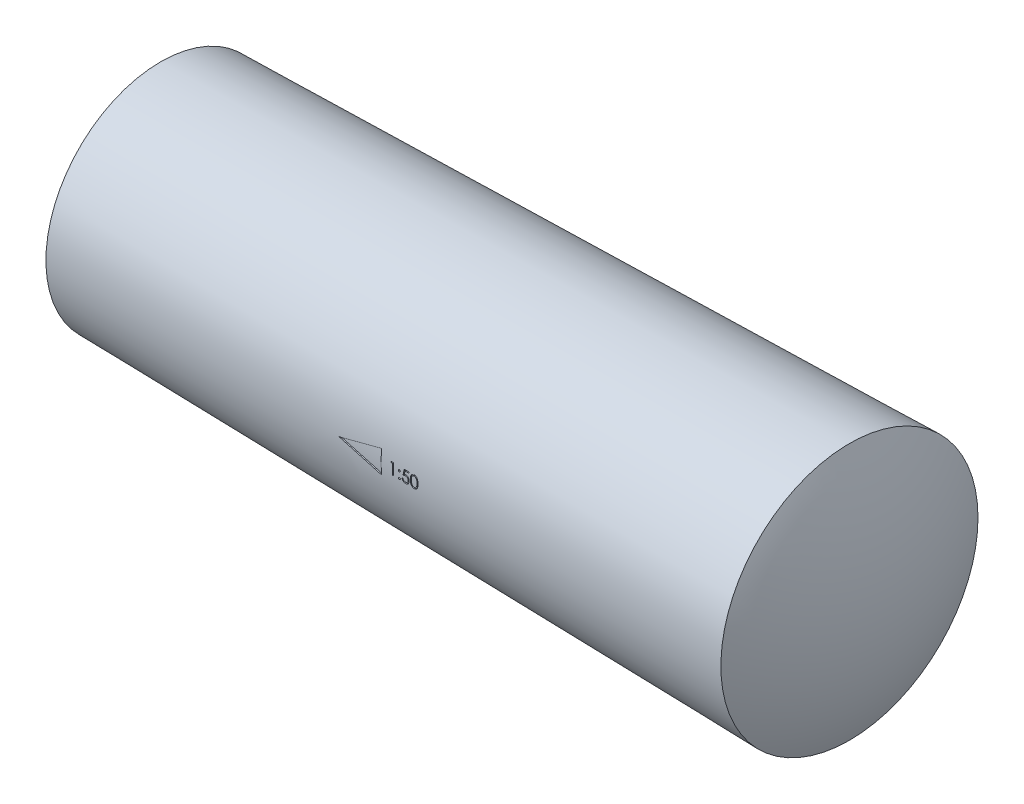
SolidWorks part; units mm, degrees
ref_plane "Front Plane" through (0, 0, 0) normal (0, 0, 1) x (1, 0, 0)
ref_plane "Top Plane" through (0, 0, 0) normal (0, 1, 0) x (1, 0, 0)
ref_plane "Right Plane" through (0, 0, 0) normal (1, 0, 0) x (0, 0, -1)
sketch "Sketch1" plane through (0, 0, 0) normal (1, 0, 0) x (0, 0, -1)
  circle A0 centre (0, 0) radius 10
  dimension "D1" = 20
extrude "Extrude1" add sketch "Sketch1" along normal mid plane 60
draft "Draft1" type of draft neutral plane draft angle 1.146 faces to draft 1 parameters "D1"=1.146
sketch "Sketch2" plane through (0, 0, 0) normal (0, 0, 1) x (1, 0, 0)
  line L0 (-30, 0) -> (-30, 10)
  line L1 (-30, 10) -> (-30, -10) construction
  line L2 (-30, 0) -> (-32.5, 0)
  line L3 (-32.5, 0) -> (-32.5, -10.6) construction
  line L4 (30, 0) -> (30, 11.2)
  line L5 (30, -11.2) -> (30, 11.2) construction
  line L6 (30, 0) -> (32.5, 0)
  line L7 (32.5, 0) -> (32.5, -10.6) construction
  line L8 (-30, -10) -> (30, -11.2) construction
  arc A0 (-32.5, 0) -> (-30, 10) centre (-11.25, 0) cw
  arc A1 (32.5, 0) -> (30, 11.2) centre (6.1618, 0) ccw
  point P14 (0, -10.6)
revolve "Revolve1" add sketch "Sketch2" angle 360 about L2
sketch "Sketch5" plane through (0, 0, 0) normal (0, 0, 1) x (1, 0, 0)
  line L0 (0, 10.6) -> (0, -10.6) construction
  line L1 (30, 11.2) -> (-30, 10) construction
  line L2 (-30, -10) -> (30, -11.2) construction
ref_plane "Plane2" through (0, 0, 0) normal (-0.02, 0, 0.9998) x (0.9998, 0, 0.02)
sketch "Sketch6" plane through (0, 0, 0) normal (-0.02, 0, 0.9998) x (0.9998, 0, 0.02)
  line L0 (0, 0) -> (0, 1)
  line L1 (0, 10.6) -> (0, -10.6) construction
  line L2 (0, 1) -> (-3.7321, 0)
  line L3 (-3.7321, 0) -> (0, -1)
  line L4 (0, -1) -> (0, 0)
  line L5 (0, -0.5) -> (4, -0.5) construction
  text T0 "1:50" font "Century Gothic" height 1
  dimension "D1" = 2
  dimension "D2" = 30
  dimension "D3" = 4
wrap "Wrap2" sketch "Sketch6" wrap type deboss source sketch "Sketch6" thickness 0.1 parameters "D1"=0.1
equation "\"D2@Sketch2\" = \"D1@Sketch2\""
